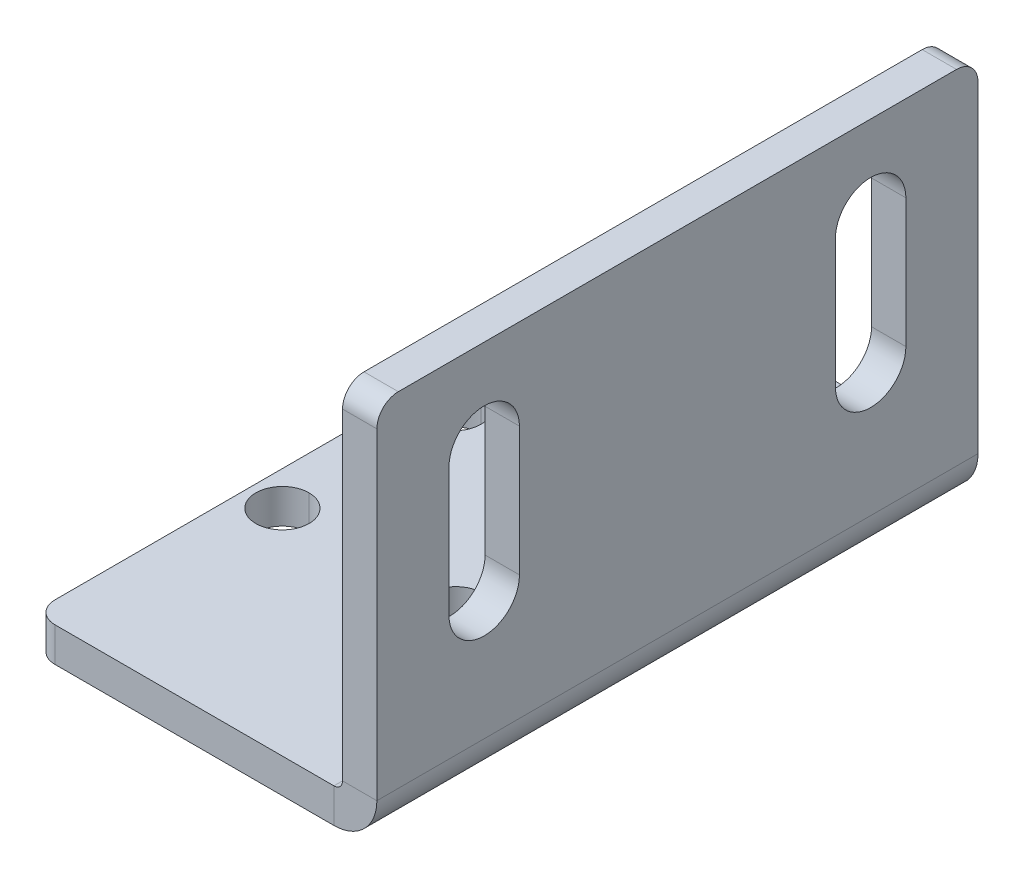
SolidWorks part; units mm, degrees
ref_plane "Front Plane" through (0, 0, 0) normal (0, 0, 1) x (1, 0, 0)
ref_plane "Top Plane" through (0, 0, 0) normal (0, 1, 0) x (1, 0, 0)
ref_plane "Right Plane" through (0, 0, 0) normal (1, 0, 0) x (0, 0, -1)
imported_body "Lukitusyksikön kiinnike.STEP<1>"
sketch "Sketch2" plane through (16, 0, 0) normal (-1, 0, 0) x (0, 0, 1)
  line L1 (-31.8931, 42.9271) -> (25.5403, 42.9271)
  line L2 (-31.8931, 42.9271) -> (-31.8931, 15.14)
  line L3 (-31.8931, 15.14) -> (25.5403, 15.14)
  line L4 (25.5403, 42.9271) -> (25.5403, 15.14)
  line L5 (-31.8931, 42.9271) -> (25.5403, 15.14) construction
  line L6 (-31.8931, 15.14) -> (25.5403, 42.9271) construction
  point P0 (-3.1764, 29.0336)
extrude "Boss-Extrude1" add sketch "Sketch2" against normal up to surface (4 mm away)
sketch "Sketch4" plane through (16, 0, 0) normal (-1, 0, 0) x (0, 0, 1)
  line L2 (-18.4, 20) -> (-18.4, 35)
  line L3 (-26.6, 35) -> (-26.6, 20)
  line L4 (26.6, 19.4766) -> (26.6, 34.4766)
  line L5 (18.4, 34.4766) -> (18.4, 19.4766)
  line L6 (-35, 5) -> (-35, 42.5) construction
  line L8 (-32.5, 45) -> (32.5, 45) construction
  arc A3 (-22.5, 15.9) -> (-18.4, 20) centre (-22.5, 20) ccw
  arc A4 (-26.6, 20) -> (-22.5, 15.9) centre (-22.5, 20) ccw
  arc A5 (-18.4, 35) -> (-26.6, 35) centre (-22.5, 35) ccw
  arc A6 (22.5, 15.3766) -> (26.6, 19.4766) centre (22.5, 19.4766) ccw
  arc A7 (18.4, 19.4766) -> (22.5, 15.3766) centre (22.5, 19.4766) ccw
  arc A8 (26.6, 34.4766) -> (18.4, 34.4766) centre (22.5, 34.4766) ccw
  dimension "D1" = 45
  dimension "D2" = 12.5
  dimension "D3" = 10
extrude "Cut-Extrude1" cut sketch "Sketch4" against normal through all
